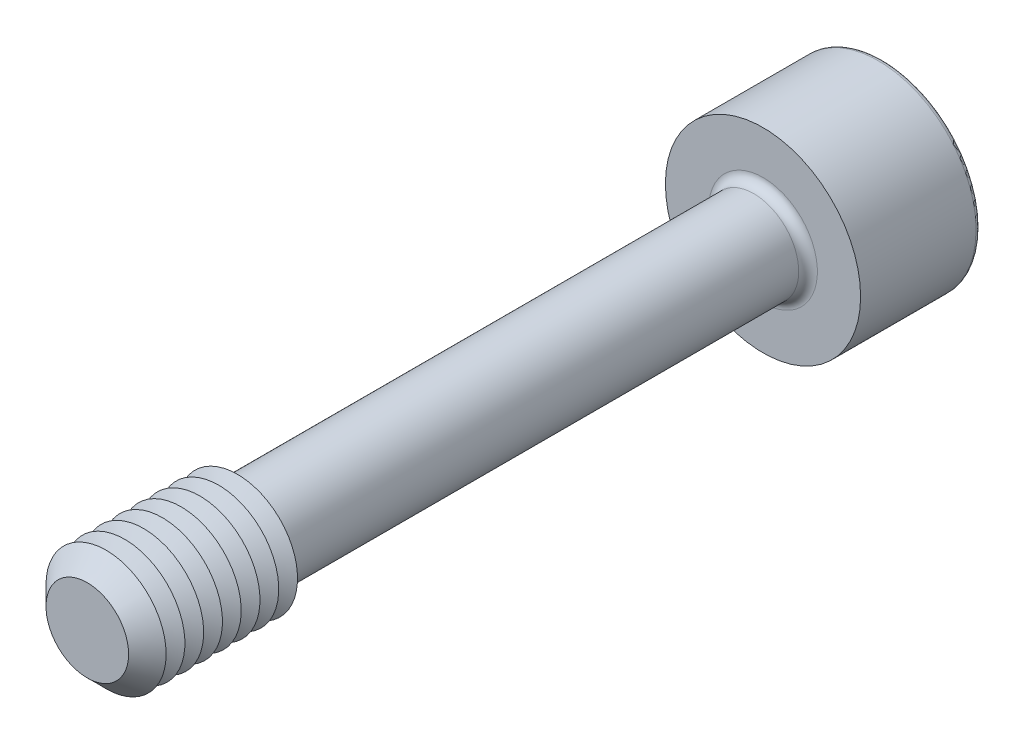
SolidWorks part; units mm, degrees
ref_plane "Front Plane" through (0, 0, 0) normal (0, 0, 1) x (1, 0, 0)
ref_plane "Top Plane" through (0, 0, 0) normal (0, 1, 0) x (1, 0, 0)
ref_plane "Right Plane" through (0, 0, 0) normal (1, 0, 0) x (0, 0, -1)
sketch "Sketch1" plane through (0, 0, 0) normal (0, 0, 1) x (1, 0, 0)
  circle A0 centre (0, 0) radius 3
  dimension "D1" = 6
extrude "Extrude1" add sketch "Sketch1" along normal mid plane 45
sketch "Sketch2" plane through (0, 0, 0) normal (1, 0, 0) x (0, 0, -1)
  line L0 (-22.5, 0) -> (-22.5, 4)
  line L1 (-22.5, 3) -> (-22.5, -3) construction
  line L2 (-22.5, 4) -> (-12.5, 4)
  line L3 (-12.5, 4) -> (-11.9226, 3)
  line L4 (22.5, 3) -> (-22.5, 3) construction
  line L5 (-11.9226, 3) -> (-11.9226, 0)
  line L6 (-11.9226, 0) -> (-22.5, 0)
  dimension "D1" = 4
  dimension "D2" = 120
  dimension "D3" = 10
revolve "Revolve1" add sketch "Sketch2" angle 360 about L6
chamfer "Chamfer1" distance 1.25 angle 45 1 edges at (0, 4, 22.5)
sketch "Sketch3" plane through (0, 0, -22.5) normal (0, 0, -1) x (-1, 0, 0)
  circle A0 centre (0, 0) radius 6.5
  dimension "D1" = 13
extrude "Extrude2" add sketch "Sketch3" along normal blind 8
sketch "Sketch4" plane through (-13.7, 0, -30.5) normal (0, 0, 1) x (1, 0, 0)
  line L2 (11.9679, -3) -> (15.4321, -3)
  line L3 (15.4321, -3) -> (17.1641, 0)
  line L4 (17.1641, 0) -> (15.4321, 3)
  line L6 (15.4321, 3) -> (11.9679, 3)
  line L7 (11.9679, 3) -> (10.2359, 0)
  line L8 (10.2359, 0) -> (11.9679, -3)
  circle A0 centre (13.7, 0) radius 3 construction
  dimension "D1" = 6
extrude "Extrude3" cut sketch "Sketch4" along normal blind 6
fillet "Fillet1" radius 0.62 1 edges at (-3, 0, -22.5)
fillet "Fillet2" radius 0.31 1 edges at (-6.5, 0, -30.5)
sketch "Sketch5" plane through (0, 0, 0) normal (1, 0, 0) x (0, 0, -1)
  line L0 (24.5, 0) -> (24.5, -3)
  line L1 (24.5, -3) -> (22.7679, 0)
  line L2 (22.7679, 0) -> (24.5, 0)
  dimension "D1" = 30
revolve "Cut-Revolve1" cut sketch "Sketch5" angle 360 about L2
sketch "Sketch6" plane through (0, 0, 0) normal (1, 0, 0) x (0, 0, -1)
  line L0 (1.332, 0) -> (-13.289, 0) construction
sketch "Sketch7" plane through (0, 0, 0) normal (1, 0, 0) x (0, 0, -1)
  line L0 (-12.5, 4) -> (-13.125, 2.9175)
  line L1 (-13.125, 2.9175) -> (-13.75, 4)
  line L2 (-12.5, 4) -> (-21.25, 4) construction
  line L3 (-13.75, 4) -> (-12.5, 4)
  dimension "D1" = 1.25
revolve "Cut-Revolve2" cut sketch "Sketch7" angle 360 about L0
pattern_linear "LPattern1" count 7 spacing 1.25 along (0, 0, 1) of "Cut-Revolve2"
